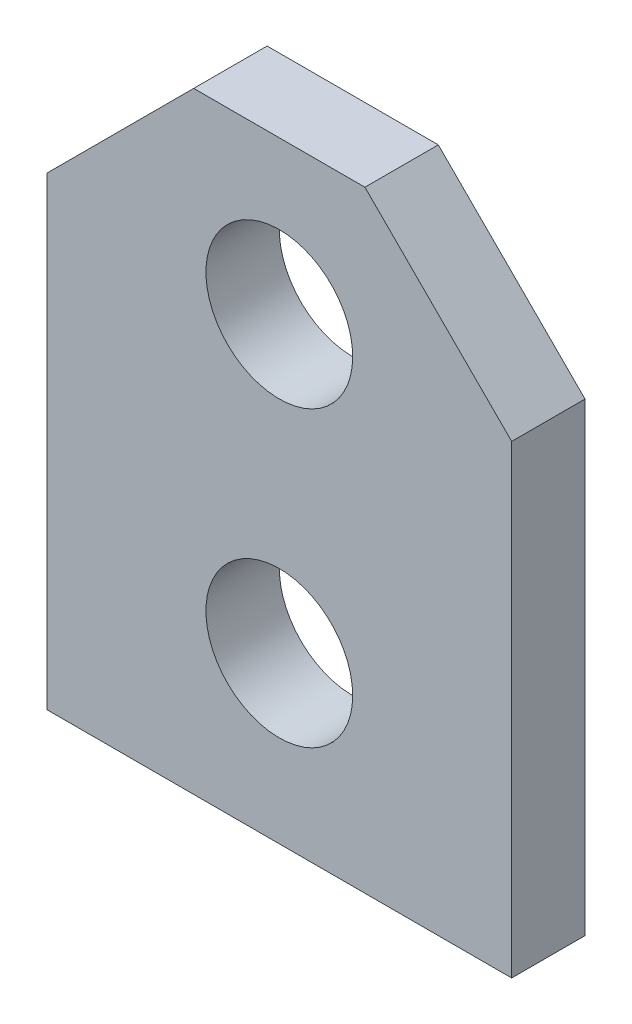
SolidWorks part; units mm, degrees
ref_plane "Front Plane" through (0, 0, 0) normal (0, 0, 1) x (1, 0, 0)
ref_plane "Top Plane" through (0, 0, 0) normal (0, 1, 0) x (1, 0, 0)
ref_plane "Right Plane" through (0, 0, 0) normal (1, 0, 0) x (0, 0, -1)
sketch "Sketch1" plane through (0, 0, 0) normal (0, 0, 1) x (1, 0, 0)
  line L1 (0, 0) -> (9.652, 0)
  line L2 (0, 0) -> (0, 12.7)
  line L3 (0, 12.7) -> (9.652, 12.7)
  line L4 (9.652, 0) -> (9.652, 12.7)
  dimension "D1" = 12.7
  dimension "D2" = 9.652
extrude "plate" add sketch "Sketch1" along normal blind 1.524
sketch "Sketch2" plane through (0, 0, 1.524) normal (0, 0, 1) x (1, 0, 0)
  line L0 (4.826, 12.7) -> (4.826, 0) construction
  line L1 (9.652, 12.7) -> (0, 12.7) construction
  line L2 (0, 0) -> (9.652, 0) construction
  circle A0 centre (4.826, 9.525) radius 1.524
  circle A1 centre (4.826, 3.429) radius 1.524
  dimension "D1" = 3.048
  dimension "D2" = 3.048
  dimension "D3" = 6.096
  dimension "D4" = 3.175
extrude "holes" cut sketch "Sketch2" against normal blind 1.524
chamfer "Chamfer1" distance 3.048 angle 45 2 edges at (9.652, 12.7, 0.762) (0, 12.7, 0.762)
